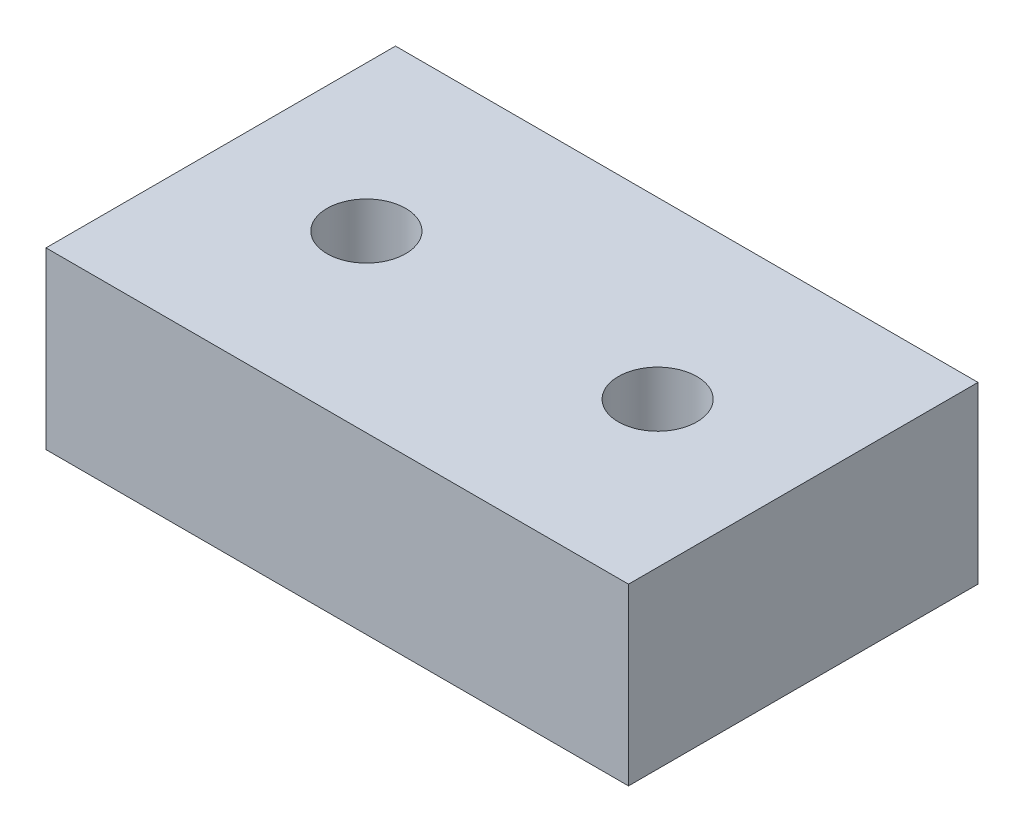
SolidWorks part; units mm, degrees
ref_plane "Ebene vorne" through (0, 0, 0) normal (0, 0, 1) x (1, 0, 0)
ref_plane "Ebene oben" through (0, 0, 0) normal (0, 1, 0) x (1, 0, 0)
ref_plane "Ebene rechts" through (0, 0, 0) normal (1, 0, 0) x (0, 0, -1)
sketch "Skizze1" plane through (0, 0, 0) normal (0, 1, 0) x (1, 0, 0)
  line L1 (0, 0) -> (100, 0)
  line L2 (0, 0) -> (0, -60)
  line L3 (0, -60) -> (100, -60)
  line L4 (100, 0) -> (100, -60)
  dimension "D1" = 100
  dimension "D2" = 60
extrude "Linear austragen1" add sketch "Skizze1" along normal blind 30
hole_wizard "Durchgangsloch für M121" positions "Skizze2" profile "Skizze3" hole size "M12" standard "DIN"
sketch "Skizze2" plane through (0, 0, 0) normal (0, -1, 0) x (1, 0, 0)
  point P0 (75, 30)
  point P1 (25, 30)
sketch "Skizze3" plane through (75, 0, 30) normal (1, 0, 0) x (0, 0, -1)
  line L0 (0, 0) -> (0, 30)
  line L1 (0, 30) -> (6.75, 30)
  line L2 (6.75, 30) -> (6.75, 0)
  line L5 (6.75, 0) -> (0, 0)
  line L11 (0, -6.35) -> (0, 107.95) construction
  dimension "Bohrerdurchmesser" = 13.5
  dimension "Bohrungstiefe" = 30
